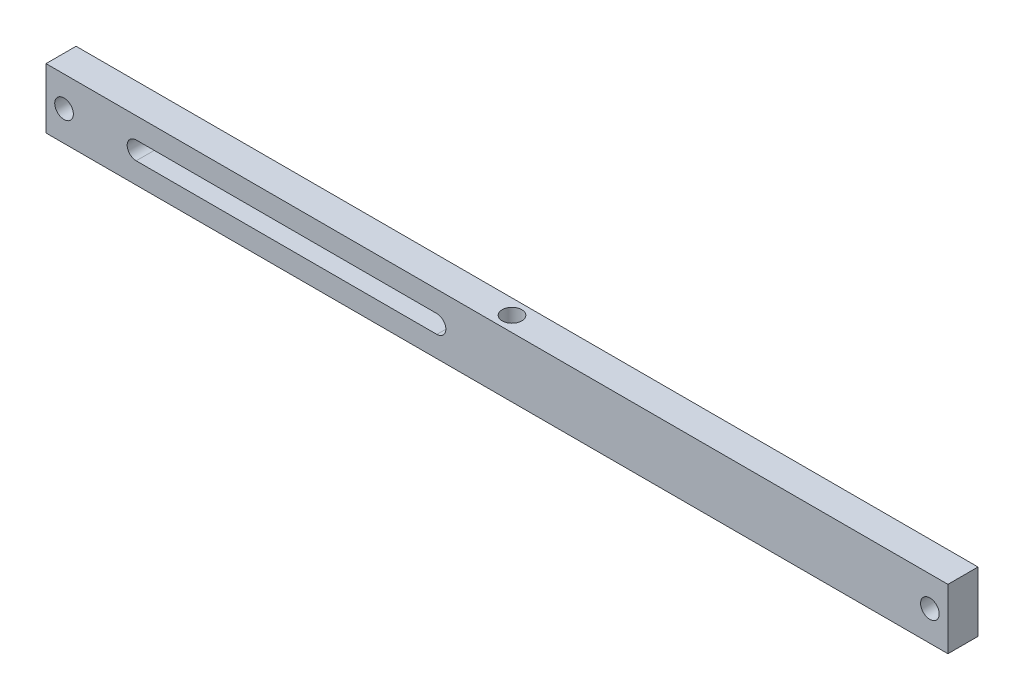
SolidWorks part; units mm, degrees
ref_plane "Plan de face" through (0, 0, 0) normal (0, 0, 1) x (1, 0, 0)
ref_plane "Plan de dessus" through (0, 0, 0) normal (0, 1, 0) x (1, 0, 0)
ref_plane "Plan de droite" through (0, 0, 0) normal (1, 0, 0) x (0, 0, -1)
sketch "Esquisse1" plane through (0, 0, 0) normal (0, 0, 1) x (1, 0, 0)
  line L0 (0, 0) -> (300, 0)
  line L1 (300, 0) -> (300, 20)
  line L2 (300, 20) -> (0, 20)
  line L3 (0, 20) -> (0, 0)
  line L4 (150, 0) -> (150, 14.8177) construction
  circle A0 centre (6, 10) radius 3.1
  circle A1 centre (294, 10) radius 3.1
  dimension "D3" = 6.2
  dimension "D1" = 20
  dimension "D2" = 300
  dimension "D4" = 6
  dimension "D5" = 10
extrude "Extrusion1" add sketch "Esquisse1" along normal mid plane 10
sketch "Esquisse2" plane through (0, 20, 0) normal (0, 1, 0) x (-1, 0, 0)
  circle A0 centre (-150, 0) radius 3.25
  dimension "D1" = 6.5
extrude "Enlèv. mat.-Extru.1" cut sketch "Esquisse2" against normal up to next
sketch "Esquisse3" plane through (0, 0, 5) normal (0, 0, 1) x (1, 0, 0)
  line L0 (30, 7) -> (130, 7)
  line L1 (130, 13) -> (30, 13)
  line L2 (0, 0) -> (300, 0) construction
  arc A0 (130, 7) -> (130, 13) centre (130, 10) ccw
  arc A1 (30, 13) -> (30, 7) centre (30, 10) ccw
  dimension "D1" = 3
  dimension "D2" = 100
  dimension "D3" = 30
  dimension "D4" = 10
extrude "Enlèv. mat.-Extru.2" cut sketch "Esquisse3" against normal up to next
ref_plane "Plan1" through (0, 10, 0) normal (0, -1, 0) x (1, 0, 0)
